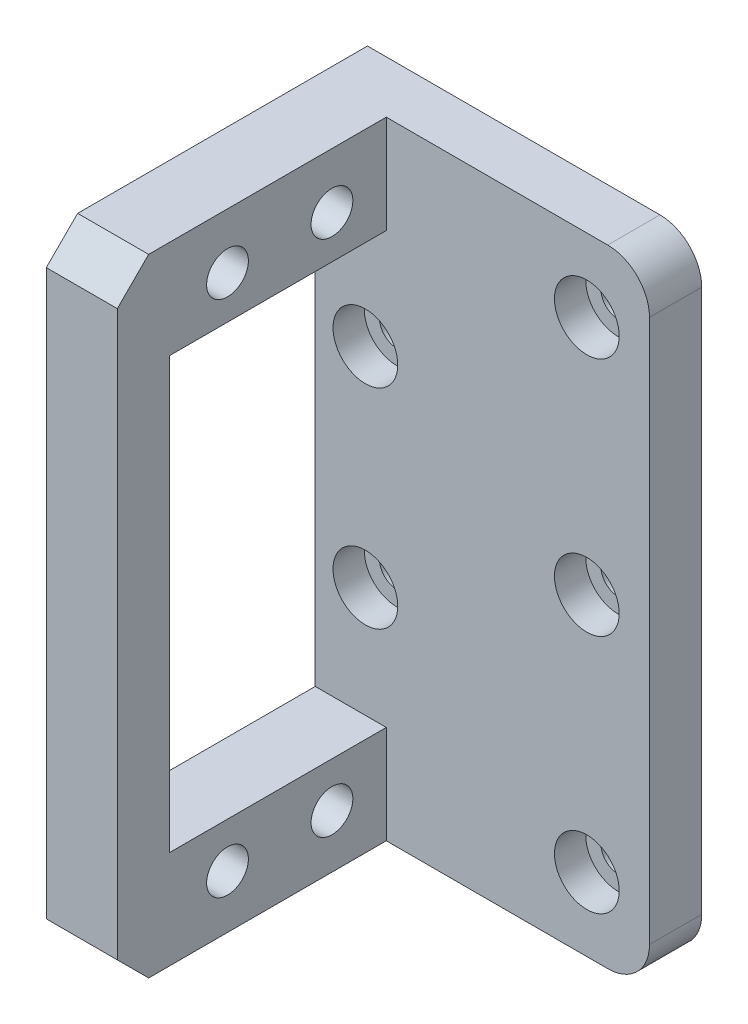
SolidWorks part; units mm, degrees
ref_plane "Спереди" through (0, 0, 0) normal (0, 0, 1) x (1, 0, 0)
ref_plane "Сверху" through (0, 0, 0) normal (0, 1, 0) x (1, 0, 0)
ref_plane "Справа" through (0, 0, 0) normal (1, 0, 0) x (0, 0, -1)
sketch "Эскиз1" plane through (0, 0, 0) normal (0, 0, 1) x (1, 0, 0)
  line L0 (-17.5, -57.25) -> (-17.5, -60) construction
  line L1 (-12.7, -60) -> (-26, -60) construction
  line L3 (-17.5, -60) -> (14.5, -60)
  line L4 (-17.5, -60) -> (-17.5, 0)
  line L5 (-17.5, 0) -> (14.5, 0)
  line L6 (14.5, -60) -> (14.5, 0)
  line L7 (12.7, 0) -> (-12.7, 0) construction
  point P8 (9.1486, 0)
  dimension "D1" = 32
extrude "Бобышка-Вытянуть1" add sketch "Эскиз1" along normal blind 5
sketch "Эскиз2" plane through (0, 0, 5) normal (0, 0, 1) x (1, 0, 0)
  line L1 (-17.5, 0) -> (-10.7, 0)
  line L2 (-17.5, 0) -> (-17.5, -9.4)
  line L3 (-17.5, -9.4) -> (-10.7, -9.4)
  line L4 (-10.7, 0) -> (-10.7, -9.4)
  line L5 (-17.5, -60) -> (-10.7, -60)
  line L6 (-17.5, -60) -> (-17.5, -50.6)
  line L7 (-17.5, -50.6) -> (-10.7, -50.6)
  line L8 (-10.7, -60) -> (-10.7, -50.6)
  dimension "D1" = 9.4
  dimension "D2" = 6.8
extrude "Бобышка-Вытянуть2" add sketch "Эскиз2" along normal up to surface (19.55 mm away)
sketch "Эскиз3" plane through (-17.5, 0, 0) normal (-1, 0, 0) x (0, 0, 1)
  circle A0 centre (10.2, -54.9) radius 2
  circle A1 centre (20.2, -54.9) radius 2
  circle A2 centre (20.2, -5.3) radius 2
  circle A3 centre (10.2, -5.3) radius 2
  dimension "D1" = 4
extrude "Вырез-Вытянуть1" cut sketch "Эскиз3" against normal up to surface (6.8 mm away)
sketch "Эскиз4" plane through (0, 0, 5) normal (0, 0, 1) x (1, 0, 0)
  line L0 (-12.7, 0) -> (-12.7, -60) construction
  line L1 (8.5, -7) -> (8.5, 0) construction
  line L2 (14.5, 0) -> (-10.7, 0) construction
  line L3 (8.5, -7) -> (8.5, -53) construction
  line L4 (8.5, -53) -> (8.5, -60) construction
  line L5 (12.7, -60) -> (-12.7, -60) construction
  line L7 (14.5, -60) -> (14.5, 0) construction
  line L8 (-12.7, -20) -> (-12.7, 0) construction
  line L9 (-12.7, -40) -> (-12.7, -60) construction
  circle A0 centre (-12.7, -20) radius 1.65
  circle A1 centre (-12.7, -40) radius 1.65
  circle A2 centre (8.5, -7) radius 1.65
  circle A3 centre (8.5, -53) radius 1.65
  circle A4 centre (8.5, -30) radius 1.65
  dimension "D3" = 3.3
  dimension "D1" = 6
  dimension "D2" = 20
  dimension "D4" = 7
extrude "Вырез-Вытянуть2" cut sketch "Эскиз4" against normal up to vertex (5 mm away)
fillet "Скругление1" radius 4 2 edges at (14.5, 0, 2.5) (14.5, -60, 2.5)
sketch "Эскиз6" plane through (0, 0, 5) normal (0, 0, 1) x (1, 0, 0)
  circle A0 centre (-12.7, -20) radius 3.1
  circle A1 centre (8.5, -7) radius 3.1
  circle A2 centre (8.5, -30) radius 3.1
  circle A3 centre (-12.7, -40) radius 3.1
  circle A4 centre (8.5, -53) radius 3.1
  dimension "D1" = 6.2
extrude "Вырез-Вытянуть4" cut sketch "Эскиз6" against normal blind 3
sketch "Эскиз7" plane through (0, 0, 24.55) normal (0, 0, 1) x (1, 0, 0)
  line L0 (-17.5, -9.4) -> (-10.7, -9.4) construction
  line L1 (-10.7, -9.4) -> (-10.7, 0) construction
  line L2 (-10.7, 0) -> (-17.5, 0) construction
  line L3 (-17.5, 0) -> (-17.5, -9.4) construction
  line L4 (-17.5, -60) -> (-10.7, -60) construction
  line L5 (-10.7, -60) -> (-10.7, -50.6) construction
  line L6 (-10.7, -50.6) -> (-17.5, -50.6) construction
  line L7 (-17.5, -50.6) -> (-17.5, -60) construction
  line L8 (-17.5, -9.4) -> (-10.7, -9.4)
  line L9 (-10.7, -9.4) -> (-10.7, 0)
  line L10 (-10.7, 0) -> (-17.5, 0)
  line L11 (-17.5, 0) -> (-17.5, -9.4)
  line L12 (-17.5, -60) -> (-10.7, -60)
  line L13 (-10.7, -60) -> (-10.7, -50.6)
  line L14 (-10.7, -50.6) -> (-17.5, -50.6)
  line L15 (-17.5, -50.6) -> (-17.5, -60)
extrude "Бобышка-Вытянуть3" add sketch "Эскиз7" along normal blind 1.2
sketch "Эскиз8" plane through (-17.5, 0, 0) normal (-1, 0, 0) x (0, 0, 1)
  line L0 (5, -50.6) -> (0, -50.6) construction
  line L1 (25.75, -60) -> (30.75, -60)
  line L2 (25.75, -60) -> (25.75, 0)
  line L3 (25.75, 0) -> (30.75, 0)
  line L4 (30.75, -60) -> (30.75, 0)
  line L5 (0, 0) -> (0, -60) construction
extrude "Бобышка-Вытянуть4" add sketch "Эскиз8" against normal up to surface (6.8 mm away)
chamfer "Фаска2" distance 3 angle 45 2 edges at (-14.1, 0, 30.75) (-14.1, -60, 30.75)
